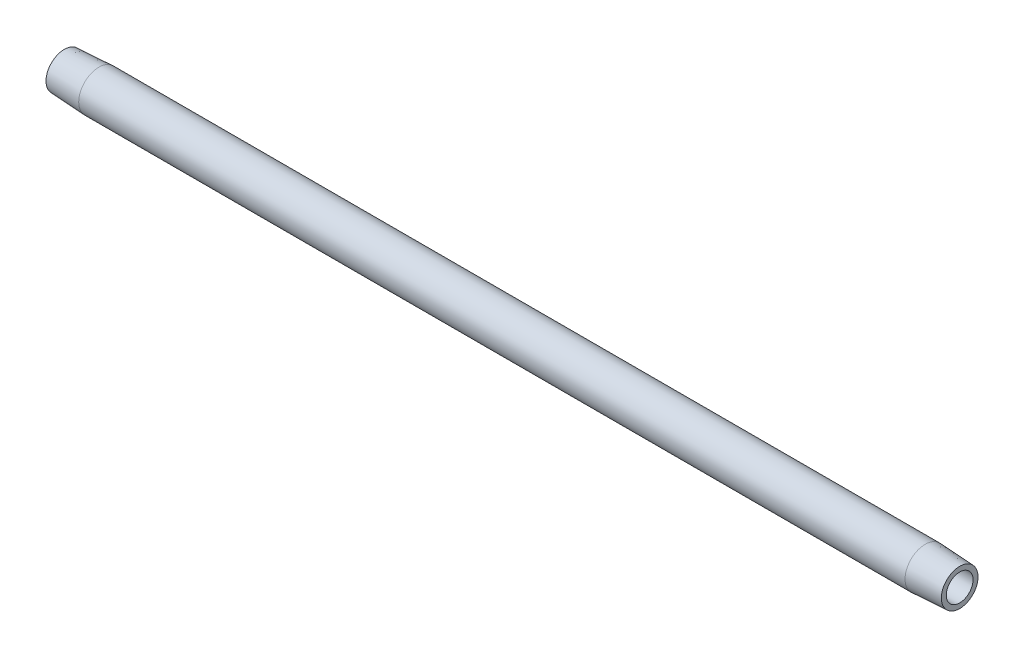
SolidWorks part; units mm, degrees
ref_plane "Front Plane" through (0, 0, 0) normal (0, 0, 1) x (1, 0, 0)
ref_plane "Top Plane" through (0, 0, 0) normal (0, 1, 0) x (1, 0, 0)
ref_plane "Right Plane" through (0, 0, 0) normal (1, 0, 0) x (0, 0, -1)
sketch "Sketch2" plane through (0, 0, 0) normal (0, 0, 1) x (1, 0, 0)
  line L0 (0.4761, 0) -> (50000.4761, 0) construction
  line L1 (0, -11.3625) -> (0, 49988.6375) construction
  line L7 (8.81, 5.1435) -> (0, 4.6818)
  line L8 (219.79, 5.1435) -> (8.81, 5.1435)
  line L9 (228.6, 4.6818) -> (219.79, 5.1435)
  line L10 (228.6, 3.4163) -> (228.6, 4.6818)
  line L11 (228.6, 3.4163) -> (0, 3.4163)
  line L12 (0, 4.6818) -> (0, 3.4163)
  dimension "D1" = 6.8326
  dimension "D2" = 10.287
  dimension "D3" = 3
  dimension "D4" = 3
  dimension "D5" = 8.81
  dimension "D6" = 8.81
  dimension "D7" = 228.6
revolve "Revolve1" add sketch "Sketch2" angle 360 about L0
